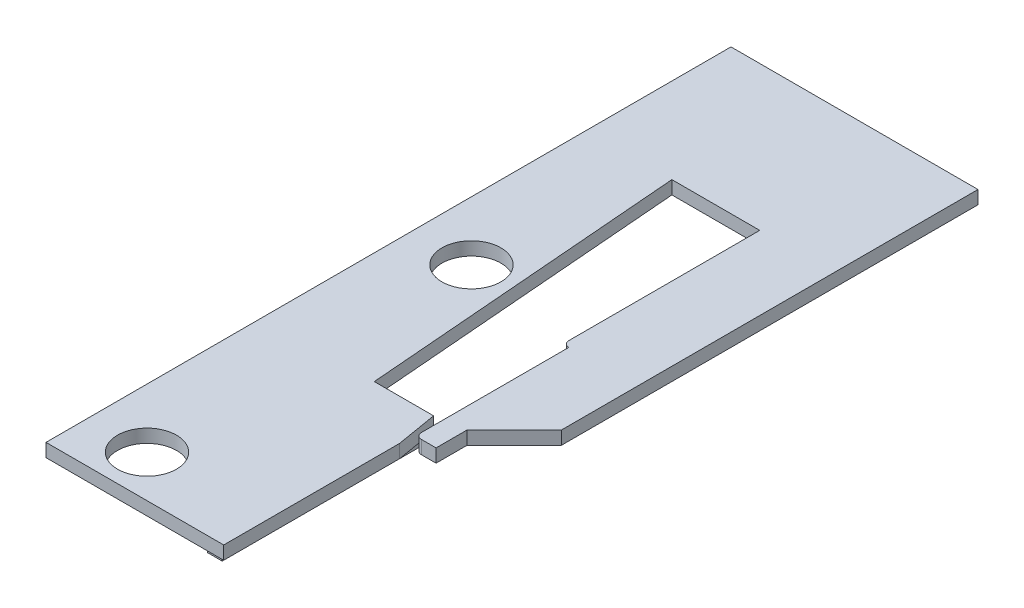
SolidWorks part; units mm, degrees
ref_plane "Front Plane" through (0, 0, 0) normal (0, 0, 1) x (1, 0, 0)
ref_plane "Top Plane" through (0, 0, 0) normal (0, 1, 0) x (1, 0, 0)
ref_plane "Right Plane" through (0, 0, 0) normal (1, 0, 0) x (0, 0, -1)
sketch "Sketch11" plane through (0, 0, 0) normal (0, 1, 0) x (1, 0, 0)
  line L0 (46.85, 4.4) -> (46.85, 32.65)
  line L1 (46.85, 4.4) -> (43.65, 1.2)
  line L3 (30.1, 32.65) -> (46.85, 32.65)
  line L4 (30.1, -13.8) -> (30.1, 32.65)
  line L5 (42.25, 8.3) -> (42.25, 9.5)
  line L6 (43.65, 1.2) -> (43.65, -0.9)
  line L7 (41.85, 9.9) -> (41.85, 22.85)
  line L8 (37.6615, 0.9) -> (41.6826, 0.9)
  line L9 (14.5207, 8.3) -> (14.5207, 9.3)
  line L10 (42.65, -0.9) -> (43.65, -0.9)
  line L11 (14.5207, 9.3) -> (15.5207, 9.3)
  line L22 (41.6826, 0.9) -> (42.15, -1.8733)
  line L25 (42.25, 8.3) -> (42.25, -0.5)
  line L28 (42.15, -1.8733) -> (42.15, -13.9)
  line L29 (42.15, -13.8) -> (30.1, -13.8)
  line L32 (41.85, 22.85) -> (35.8916, 22.85)
  line L33 (35.8916, 22.85) -> (37.6615, 0.9)
  arc A0 (41.85, 9.9) -> (42.25, 9.5) centre (42.25, 9.9) ccw
  arc A1 (42.25, -0.5) -> (42.65, -0.9) centre (42.65, -0.5) ccw
  circle A4 centre (34.1, 11.05) radius 2
  circle A5 centre (34.1, -10.95) radius 2
  point P72 (43.65, 5.2)
sketch "Sketch13" plane through (0, 0, 0) normal (0, 1, 0) x (1, 0, 0)
  line L1 (43.25, 13.5) -> (42.25, 13.5)
  line L2 (43.25, 13.5) -> (43.25, -0.5)
  line L3 (43.25, -0.5) -> (42.25, -0.5)
  line L4 (42.25, 13.5) -> (42.25, -0.5)
  line L5 (40.75, 0.5) -> (41.75, 0.5)
  line L6 (40.75, 0.5) -> (40.75, -13.5)
  line L7 (40.75, -13.5) -> (41.75, -13.5)
  line L8 (41.75, 0.5) -> (41.75, -13.5)
extrude "Boss-Extrude1" add sketch "Sketch11" along normal blind 0.9
extrude "Boss-Extrude3" add sketch "Sketch13" against normal blind 0.4
